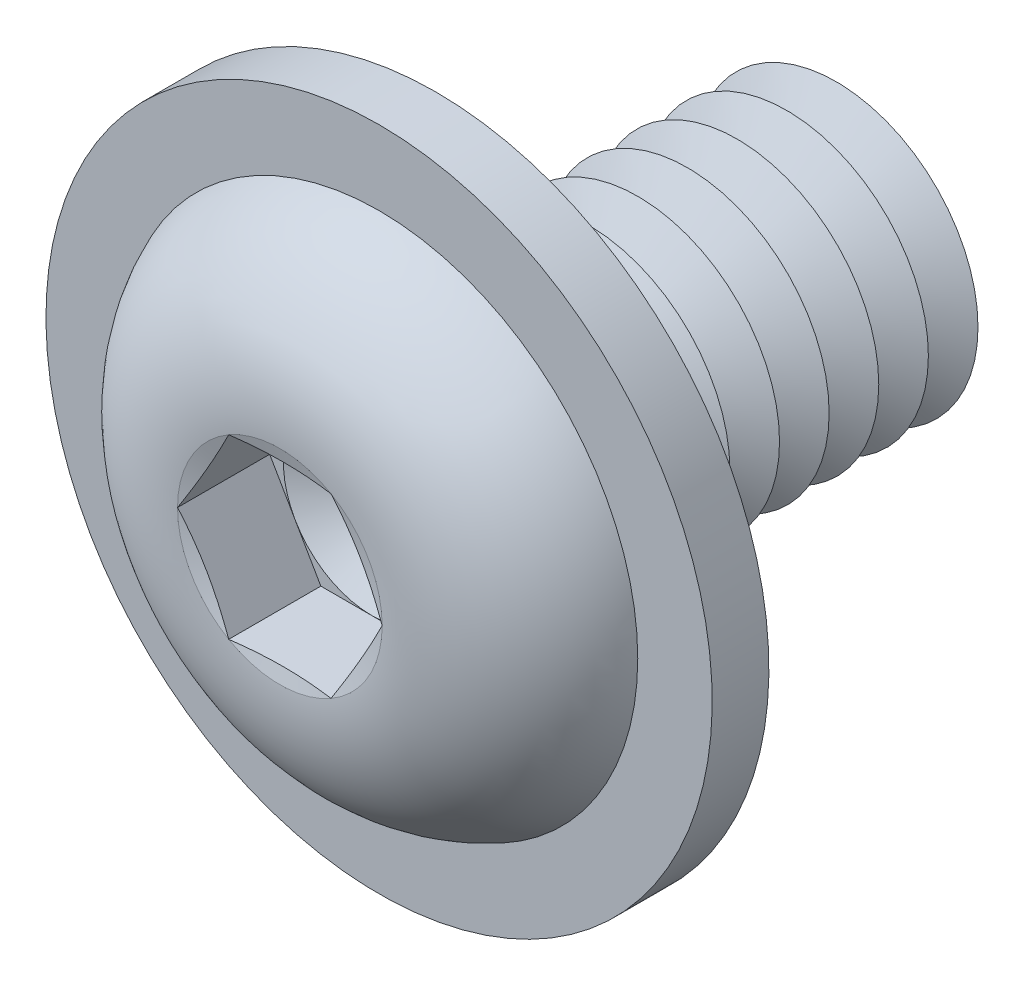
SolidWorks part; units mm, degrees
ref_plane "Front Plane" through (0, 0, 0) normal (0, 0, 1) x (1, 0, 0)
ref_plane "Top Plane" through (0, 0, 0) normal (0, 1, 0) x (1, 0, 0)
ref_plane "Right Plane" through (0, 0, 0) normal (1, 0, 0) x (0, 0, -1)
sketch "Sketch1" plane through (0, 0, 0) normal (1, 0, 0) x (0, 0, -1)
  line L0 (0, 2) -> (0, 3.8)
  line L3 (0, 2) -> (6, 2)
  line L4 (6, 2) -> (6, 0)
  line L5 (6, 0) -> (-2.2, 0) construction
  line L6 (-2.2, 0) -> (6, 0)
  line L7 (-2.2, 1.4434) -> (-2.2, 0.7217) construction
  line L8 (-2.2, 0.7217) -> (-2.2, 0)
  line L9 (-2.2, 1.4434) -> (-2.0066, 0.7217)
  line L10 (-2.0066, 0.7217) -> (-2.2, 0.7217)
  line L11 (6, 0) -> (22.7481, 0) construction
  line L12 (0, 3.8) -> (-2.2, 3.8) construction
  arc A1 (0, 3.8) -> (-2.2, 1.4434) centre (0, 1.5948) ccw
  point P8 (6, 1)
  dimension "D1" = 7.6
  dimension "D2" = 4
  dimension "D3" = 2.2
  dimension "D4" = 2.8868
  dimension "D5" = 6
  dimension "D6" = 15
revolve "Revolve1" add sketch "Sketch1" angle 360 about L5
fillet "Fillet1" radius 0.35 1 edges at (-2, 0, 0)
sketch "Sketch2" plane through (0, 0, 0) normal (1, 0, 0) x (0, 0, -1)
  line L0 (5.65, 2) -> (6.35, 2)
  line L1 (6, 2) -> (0.35, 2) construction
  line L2 (6.35, 2) -> (6, 1.3938)
  line L3 (6, -2) -> (6, 2) construction
  line L4 (6, 1.3938) -> (5.65, 2)
  dimension "D1" = 0.7
revolve "Cut-Revolve1" cut sketch "Sketch2" angle 360 about axis through (0, 0, -6) along (0, 0, -1)
pattern_linear "LPattern1" count 8 spacing 0.7 along (0, 0, 1) of "Cut-Revolve1"
sketch "Sketch3" plane through (0, 0, 2.2) normal (0, 0, 1) x (1, 0, 0)
  line L7 (0.7217, 1.25) -> (-0.7217, 1.25)
  line L8 (-0.7217, 1.25) -> (-1.4434, 0)
  line L9 (-1.4434, 0) -> (-0.7217, -1.25)
  line L10 (-0.7217, -1.25) -> (0.7217, -1.25)
  line L11 (0.7217, -1.25) -> (1.4434, 0)
  line L12 (1.4434, 0) -> (0.7217, 1.25)
  circle A0 centre (0, 0) radius 1.25 construction
  circle A3 centre (0, 0) radius 1.4434 construction
extrude "Cut-Extrude1" cut sketch "Sketch3" against normal blind 1.3
sketch "Sketch4" plane through (0, 0, 0.9) normal (0, 0, 1) x (1, 0, 0)
  line L1 (0.7217, 1.25) -> (-0.7217, 1.25) construction
  circle A0 centre (0, 0) radius 1.25
extrude "Cut-Extrude2" cut sketch "Sketch4" against normal through all draft 60
sketch "Sketch5" plane through (0, 0, 0) normal (0, 0, -1) x (-1, 0, 0)
  circle A0 centre (0, 0) radius 4.7
  circle A1 centre (0, 0) radius 2.35
  circle A2 centre (0, 0) radius 2.35 construction
  dimension "D1" = 9.4
extrude "Boss-Extrude1" add sketch "Sketch5" against normal blind 0.8
